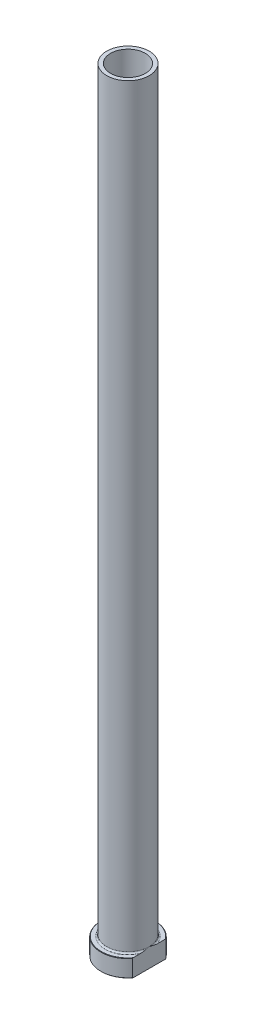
SolidWorks part; units mm, degrees
ref_plane "Front Plane" through (0, 0, 0) normal (0, 0, 1) x (1, 0, 0)
ref_plane "Top Plane" through (0, 0, 0) normal (0, 1, 0) x (1, 0, 0)
ref_plane "Right Plane" through (0, 0, 0) normal (1, 0, 0) x (0, 0, -1)
sketch "Sketch1" plane through (0, 0, 0) normal (0, 0, 1) x (1, 0, 0)
  line L0 (-9, 400) -> (-11, 400)
  line L1 (-11, 400) -> (-11, 9)
  line L2 (-11, 9) -> (-14, 9)
  line L3 (-14, 9) -> (-14, 0)
  line L4 (13.75, 0) -> (-13.75, 0) construction
  line L5 (-14, 0) -> (-9.25, 0)
  line L6 (-9, 345) -> (-9, 400)
  line L7 (0, 92.1877) -> (0, -15.5353) construction
  line L8 (0, -15.4) -> (0, 15.4) construction
  line L9 (-9, 345) -> (-9.25, 333)
  line L10 (-9.25, 333) -> (-9.25, 0)
  dimension "D1" = 0.25
  dimension "ID" = 18
  dimension "OD" = 22
  dimension "L" = 400
  dimension "H" = 28
  dimension "T" = 9
  dimension "N" = 55
  dimension "D2" = 12
  dimension "L-N" = 345
revolve "Revolve1" add sketch "Sketch1" angle 360 about L7
fillet "Fillet1" radius 0.8 1 edges at (0, 9, 11)
chamfer "Chamfer1" distance 0.2 angle 45 2 edges at (0, 9, 14) (0, 0, 14)
sketch "Sketch2" plane through (0, 0, 0) normal (0, -1, 0) x (1, 0, 0)
  line L0 (11, 8.6603) -> (11, -8.6603)
  circle A0 centre (0, 0) radius 14 construction
  arc A1 (11, 8.6603) -> (11, -8.6603) centre (0, 0) cw
  circle A2 centre (0, 0) radius 11 construction
extrude "Cut-Extrude1" cut sketch "Sketch2" against normal through all
chamfer "Chamfer2" distance 0.5 angle 45 1 edges at (0, 0, 9.25)
